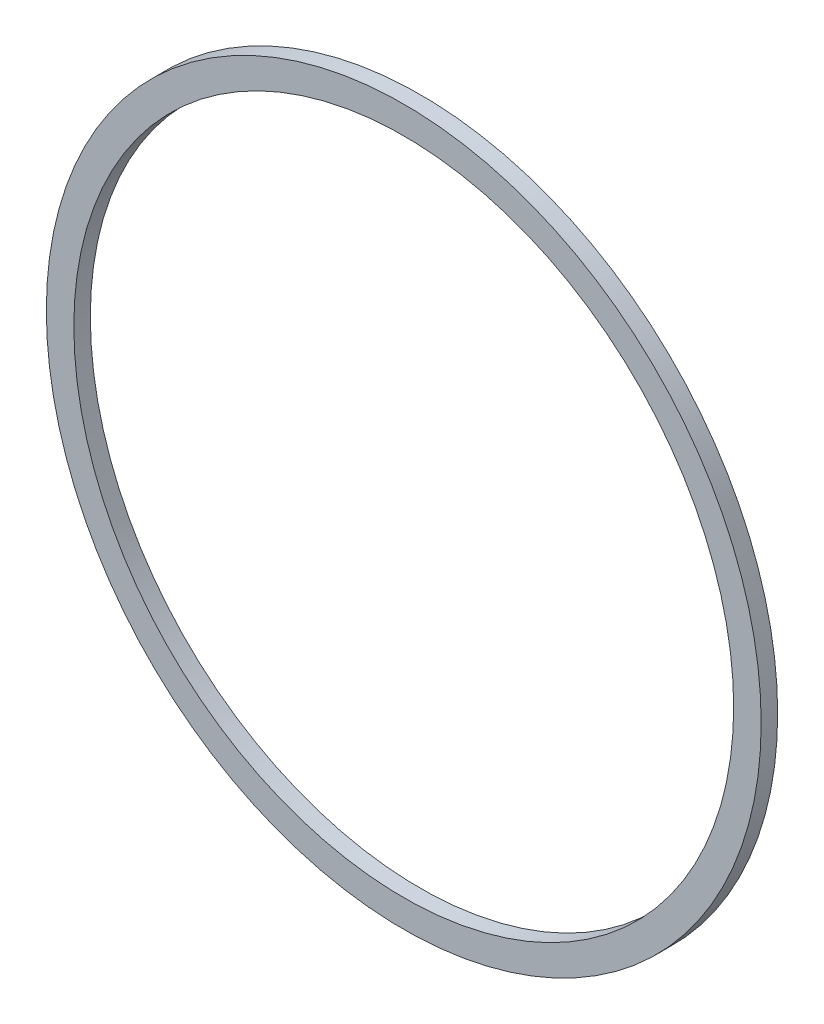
SolidWorks part; units mm, degrees
ref_plane "Plan de face" through (0, 0, 0) normal (0, 0, 1) x (1, 0, 0)
ref_plane "Plan de dessus" through (0, 0, 0) normal (0, 1, 0) x (1, 0, 0)
ref_plane "Plan de droite" through (0, 0, 0) normal (1, 0, 0) x (0, 0, -1)
sketch "Esquisse1" plane through (0, 0, 0) normal (0, 0, 1) x (1, 0, 0)
  circle A0 centre (0, 0) radius 30
  circle A1 centre (0, 0) radius 32.5
  dimension "D1" = 60
  dimension "D2" = 65
extrude "Extrusion1" add sketch "Esquisse1" along normal blind 1.5
